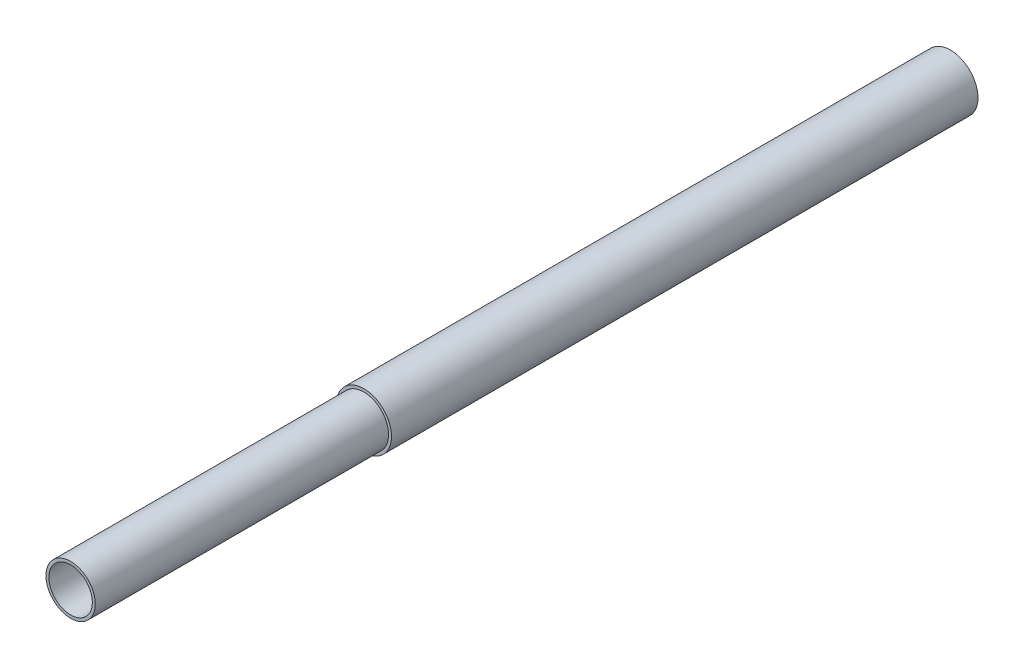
SolidWorks part; units mm, degrees
ref_plane "Front" through (0, 0, 0) normal (0, 0, 1) x (1, 0, 0)
ref_plane "Top" through (0, 0, 0) normal (0, 1, 0) x (1, 0, 0)
ref_plane "Right" through (0, 0, 0) normal (1, 0, 0) x (0, 0, -1)
sketch "Sketch1" plane through (0, 0, 0) normal (0, 0, 1) x (1, 0, 0)
  circle A0 centre (0, 0) radius 2.3901
extrude "Extrude2" add sketch "Sketch1" along normal blind 50.8
sketch "Sketch2" plane through (0, 0, 50.8) normal (0, 0, 1) x (1, 0, 0)
  circle A0 centre (0, 0) radius 2.1361
extrude "Extrude3" add sketch "Sketch2" along normal blind 25.4
sketch "Sketch3" plane through (0, 0, 0) normal (0, 0, 1) x (1, 0, 0)
  circle A0 centre (0, 0) radius 1.8821
extrude "Extrude5" cut sketch "Sketch3" against normal blind 50.8 from surface at 76.2
